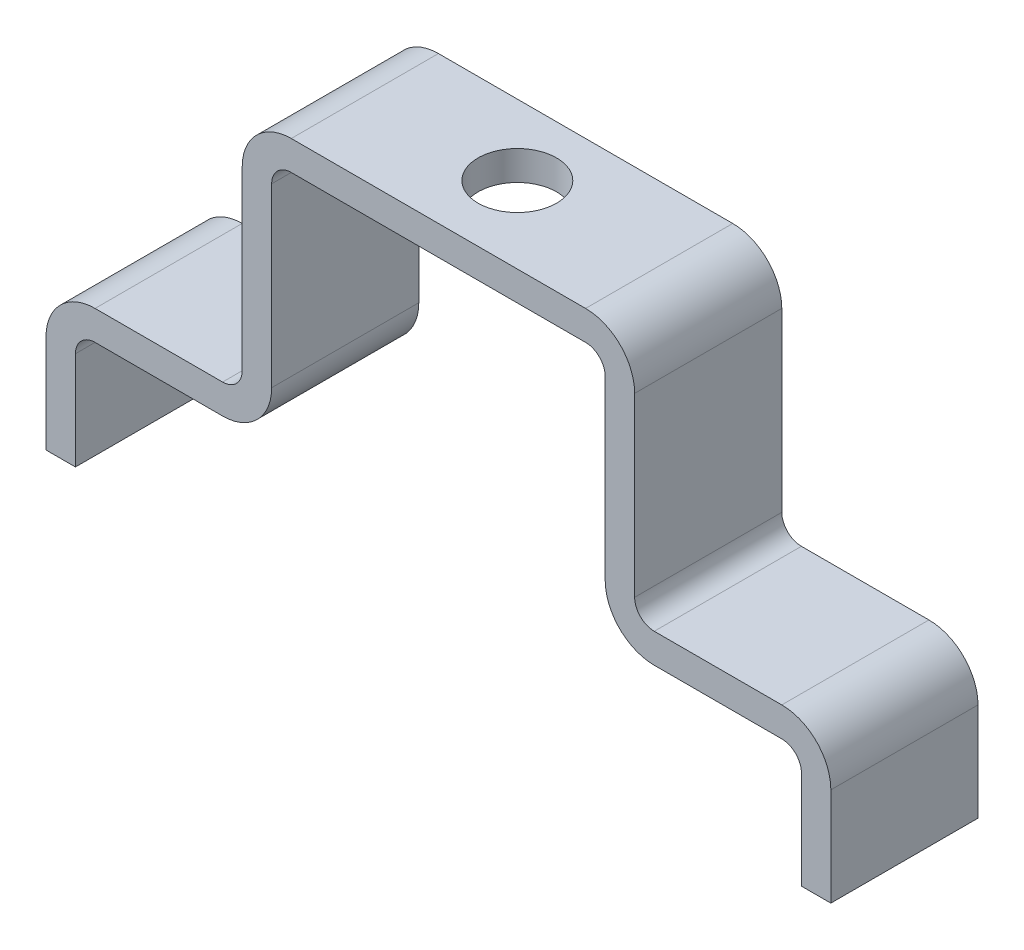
SolidWorks part; units mm, degrees
ref_plane "Front Plane" through (0, 0, 0) normal (0, 0, 1) x (1, 0, 0)
ref_plane "Top Plane" through (0, 0, 0) normal (0, 1, 0) x (1, 0, 0)
ref_plane "Right Plane" through (0, 0, 0) normal (1, 0, 0) x (0, 0, -1)
sketch "Sketch1" plane through (0, 0, 0) normal (0, 0, 1) x (1, 0, 0)
  line L0 (-24.9552, 25) -> (15.0448, 25)
  line L1 (-24.9552, 25) -> (-24.9552, 0)
  line L2 (-24.9552, 0) -> (-44.9552, 0)
  line L3 (15.0448, 25) -> (15.0448, 0)
  line L4 (15.0448, 0) -> (35.0448, 0)
  line L5 (-44.9552, 0) -> (-44.9552, -15)
  line L6 (35.0448, 0) -> (35.0448, -15)
extrude "Extrude-Thin1" add sketch "Sketch1" along normal blind 15 thin
sketch "Sketch2" plane through (0, 25, 0) normal (0, 1, 0) x (-1, 0, 0)
  circle A0 centre (4.7217, 7.1887) radius 4
extrude "Cut-Extrude1" cut sketch "Sketch2" against normal through all
